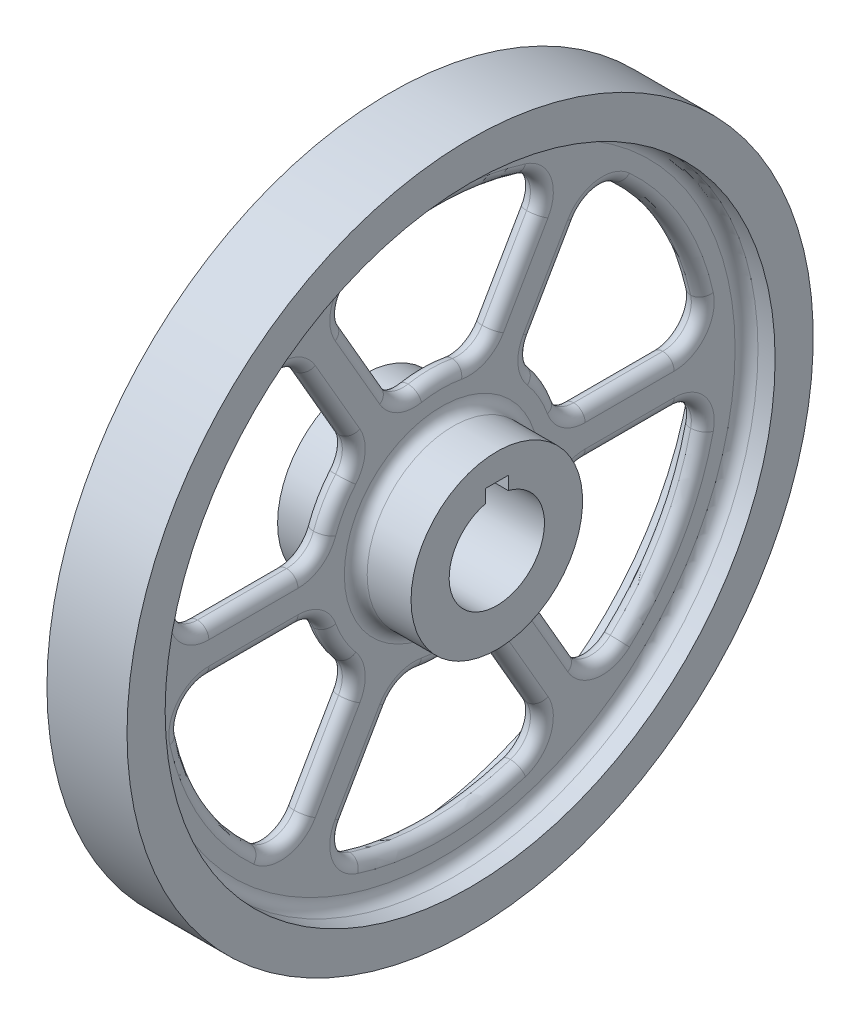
SolidWorks part; units mm, degrees
ref_plane "Plan1" through (0, 0, 0) normal (0, 0, 1) x (1, 0, 0)
ref_plane "Plan2" through (0, 0, 0) normal (0, 1, 0) x (1, 0, 0)
ref_plane "Plan3" through (0, 0, 0) normal (1, 0, 0) x (0, 0, -1)
sketch "Esquisse1" plane through (0, 0, 0) normal (0, 0, 1) x (1, 0, 0)
  line L0 (-43.7948, 0) -> (41.023, 0) construction
  line L1 (-35, 25) -> (-35, 45)
  line L2 (-35, 45) -> (-12, 45)
  line L3 (-35, 25) -> (35, 25)
  line L4 (-6, 51) -> (-6, 154)
  line L5 (-12, 160) -> (-21, 160)
  line L6 (-21, 160) -> (-21, 180)
  line L7 (-21, 180) -> (21, 180)
  line L9 (21, 160) -> (21, 180)
  line L10 (12, 160) -> (21, 160)
  line L11 (6, 51) -> (6, 154)
  line L12 (35, 45) -> (12, 45)
  line L13 (35, 25) -> (35, 45)
  arc A0 (-6, 154) -> (-12, 160) centre (-12, 154) ccw
  arc A1 (-12, 45) -> (-6, 51) centre (-12, 51) ccw
  arc A2 (12, 45) -> (6, 51) centre (12, 51) cw
  arc A3 (12, 160) -> (6, 154) centre (12, 154) ccw
  point P24 (0, 180)
  point P26 (0, 25)
  dimension "D4" = 6
  dimension "D8" = 6
  dimension "D1" = 12
  dimension "D2" = 180
  dimension "D3" = 25
  dimension "D5" = 20
  dimension "D6" = 20
  dimension "D7" = 20
revolve "Base-Révolution" add sketch "Esquisse1" angle 360 about L0
sketch "Esquisse2" plane through (0, 0, 0) normal (1, 0, 0) x (0, 0, -1)
  line L0 (6, 23.3622) -> (6, 31.2)
  line L1 (6, 31.2) -> (-6, 31.2)
  line L2 (-6, 31.2) -> (-6, 23.3622)
  line L3 (-6, 23.3622) -> (6, 23.3622)
  dimension "D1" = 6
  dimension "D2" = 12
  dimension "D3" = 31.2
extrude "Enlèv. mat.-Extru.1" cut sketch "Esquisse2" against normal mid plane 72
sketch "Esquisse3" plane through (0, 0, 0) normal (1, 0, 0) x (0, 0, -1)
  line L0 (0, 0) -> (0, 180) construction
  line L1 (75.306, 12) -> (122.0492, 12)
  line L2 (27.2607, 71.2169) -> (50.6323, 111.6977)
  line L3 (-27.2607, 71.2169) -> (-50.6323, 111.6977)
  line L5 (48.0453, 59.2169) -> (71.4169, 99.6977)
  line L6 (0, 0) -> (151.5544, 87.5) construction
  line L7 (48.0453, -59.2169) -> (71.4169, -99.6977)
  line L8 (75.306, -12) -> (122.0492, -12)
  line L9 (0, 0) -> (151.5544, -87.5) construction
  line L10 (-27.2607, -71.2169) -> (-50.6323, -111.6977)
  line L11 (27.2607, -71.2169) -> (50.6323, -111.6977)
  line L12 (0, 0) -> (0, -175) construction
  line L13 (-75.306, -12) -> (-122.0492, -12)
  line L14 (-48.0453, -59.2169) -> (-71.4169, -99.6977)
  line L15 (0, 0) -> (-151.5544, -87.5) construction
  line L16 (-48.0453, 59.2169) -> (-71.4169, 99.6977)
  line L17 (-75.306, 12) -> (-122.0492, 12)
  line L18 (0, 0) -> (-151.5544, 87.5) construction
  circle A0 centre (0, 0) radius 180 construction
  arc A1 (11.5946, 63.9575) -> (-11.5946, 63.9575) centre (0, 0) ccw
  arc A2 (42.1589, 133.5014) -> (-42.1589, 133.5014) centre (0, 0) ccw
  arc A3 (136.6951, 30.24) -> (122.0492, 12) centre (122.0492, 27) cw
  arc A5 (42.1589, 133.5014) -> (50.6323, 111.6977) centre (37.6419, 119.1977) cw
  arc A6 (-71.4169, 99.6977) -> (-94.5361, 103.2614) centre (-84.4073, 92.1977) ccw
  arc A8 (27.2607, 71.2169) -> (11.5946, 63.9575) centre (14.2703, 78.7169) cw
  arc A9 (-27.2607, 71.2169) -> (-11.5946, 63.9575) centre (-14.2703, 78.7169) ccw
  arc A10 (-42.1589, 133.5014) -> (-50.6323, 111.6977) centre (-37.6419, 119.1977) ccw
  arc A11 (94.5361, 103.2614) -> (71.4169, 99.6977) centre (84.4073, 92.1977) ccw
  arc A13 (75.306, 12) -> (61.1862, 21.9375) centre (75.306, 27) cw
  arc A14 (48.0453, 59.2169) -> (49.5915, 42.02) centre (61.0357, 51.7169) ccw
  arc A15 (94.5361, -103.2614) -> (71.4169, -99.6977) centre (84.4073, -92.1977) cw
  arc A17 (136.6951, -30.24) -> (122.0492, -12) centre (122.0492, -27) ccw
  arc A19 (48.0453, -59.2169) -> (49.5915, -42.02) centre (61.0357, -51.7169) cw
  arc A20 (75.306, -12) -> (61.1862, -21.9375) centre (75.306, -27) ccw
  arc A21 (-42.1589, -133.5014) -> (-50.6323, -111.6977) centre (-37.6419, -119.1977) cw
  arc A23 (42.1589, -133.5014) -> (50.6323, -111.6977) centre (37.6419, -119.1977) ccw
  arc A25 (-27.2607, -71.2169) -> (-11.5946, -63.9575) centre (-14.2703, -78.7169) cw
  arc A26 (27.2607, -71.2169) -> (11.5946, -63.9575) centre (14.2703, -78.7169) ccw
  arc A27 (-136.6951, -30.24) -> (-122.0492, -12) centre (-122.0492, -27) cw
  arc A29 (-94.5361, -103.2614) -> (-71.4169, -99.6977) centre (-84.4073, -92.1977) ccw
  arc A31 (-75.306, -12) -> (-61.1862, -21.9375) centre (-75.306, -27) cw
  arc A32 (-48.0453, -59.2169) -> (-49.5915, -42.02) centre (-61.0357, -51.7169) ccw
  arc A34 (-94.5361, 103.2614) -> (-136.6951, 30.24) centre (0, 0) ccw
  arc A35 (-136.6951, 30.24) -> (-122.0492, 12) centre (-122.0492, 27) ccw
  arc A36 (-49.5915, 42.02) -> (-61.1862, 21.9375) centre (0, 0) ccw
  arc A37 (-48.0453, 59.2169) -> (-49.5915, 42.02) centre (-61.0357, 51.7169) cw
  arc A38 (-75.306, 12) -> (-61.1862, 21.9375) centre (-75.306, 27) ccw
  arc A39 (-42.1589, -133.5014) -> (42.1589, -133.5014) centre (0, 0) ccw
  arc A40 (-136.6951, -30.24) -> (-94.5361, -103.2614) centre (0, 0) ccw
  arc A41 (61.1862, 21.9375) -> (49.5915, 42.02) centre (0, 0) ccw
  arc A42 (136.6951, 30.24) -> (94.5361, 103.2614) centre (0, 0) ccw
  arc A43 (94.5361, -103.2614) -> (136.6951, -30.24) centre (0, 0) ccw
  arc A44 (49.5915, -42.02) -> (61.1862, -21.9375) centre (0, 0) ccw
  arc A45 (-11.5946, -63.9575) -> (11.5946, -63.9575) centre (0, 0) ccw
  arc A46 (-61.1862, -21.9375) -> (-49.5915, -42.02) centre (0, 0) ccw
  point P12 (0, 0)
  point P13 (-60.672, 35.029)
  dimension "D1" = 130
  dimension "D2" = 280
  dimension "D3" = 15
  dimension "D4" = 15
  dimension "D5" = 15
extrude "Enlèv. mat.-Extru.2" cut sketch "Esquisse3" against normal mid plane 15
fillet "Congé1" radius 6
